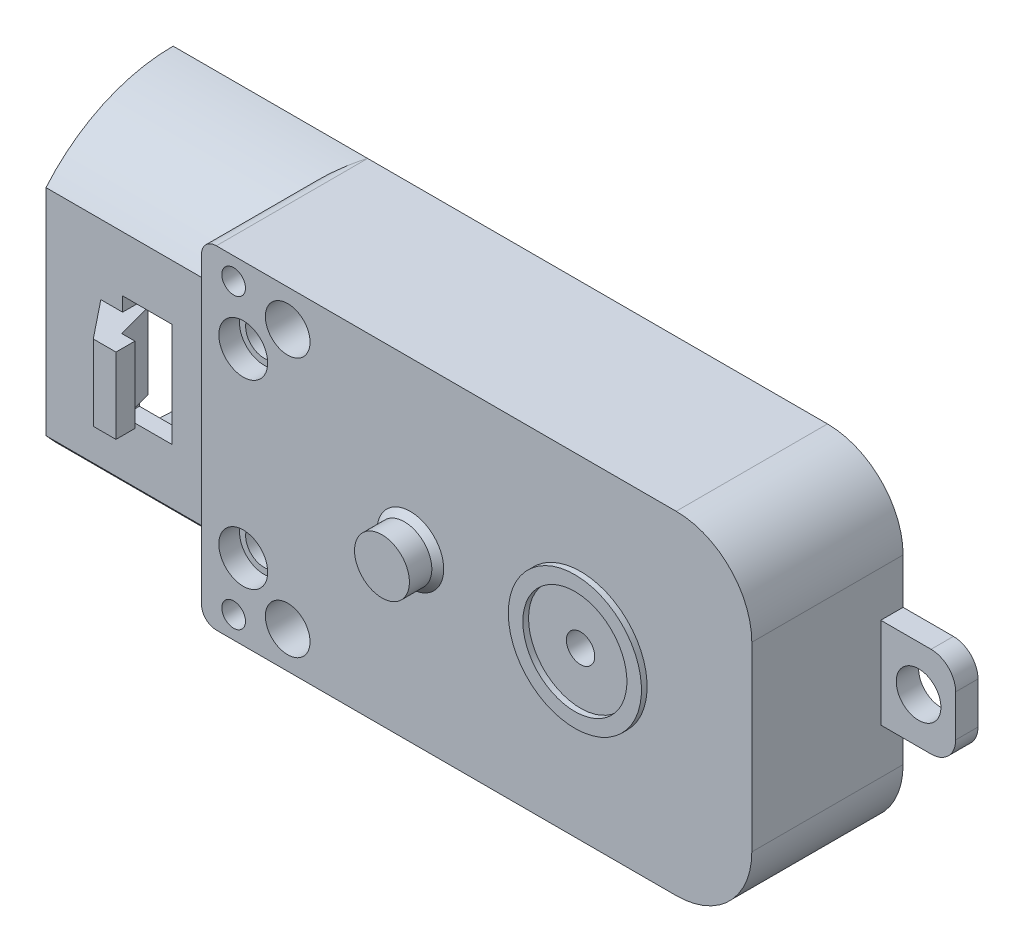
SolidWorks part; units mm, degrees
ref_plane "Front" through (0, 0, 0) normal (0, 0, 1) x (1, 0, 0)
ref_plane "Top" through (0, 0, 0) normal (0, 1, 0) x (1, 0, 0)
ref_plane "Right" through (0, 0, 0) normal (1, 0, 0) x (0, 0, -1)
sketch "Sketch1" plane through (0, 0, 0) normal (0, 0, 1) x (1, 0, 0)
  line L0 (11.5, 0) -> (-49.9329, 0) construction
  line L1 (11.5, 11.176) -> (-37.522, 11.176)
  line L2 (11.5, 11.176) -> (11.5, -11.176)
  line L3 (11.5, -11.176) -> (-37.522, -11.176)
  line L4 (-37.522, 11.176) -> (-37.522, -11.176)
  dimension "D1" = 49.022
  dimension "D2" = 22.352
  dimension "D3" = 11.5
extrude "Extrude1" add sketch "Sketch1" along normal blind 10.16
sketch "Sketch2" plane through (0, 0, 10.16) normal (0, 0, 1) x (1, 0, 0)
  line L0 (11.5, -11.176) -> (11.5, 11.176) construction
  line L4 (11.5, 11.176) -> (-37.522, 11.176) construction
  circle A0 centre (0, 0) radius 0.9525
  circle A1 centre (-22.6503, 6.0833) radius 1.2319
  circle A2 centre (-23.295, 9.691) radius 0.795
  circle A3 centre (-19.6658, 8.7122) radius 1.5
  dimension "D1" = 2.4638
  dimension "D2" = 1.59
  dimension "D3" = 1.485
  dimension "D4" = 5.0927
  dimension "D5" = 2.4638
  dimension "D6" = 3
  dimension "D7" = 31.1658
  dimension "D9" = 34.795
  dimension "D10" = 1.905
  dimension "D8" = 34.1503
extrude "Cut-Extrude1" cut sketch "Sketch2" against normal through all
ref_plane "Plane1" through (0, 0, 0) normal (0, 1, 0) x (-1, 0, 0)
mirror "Mirror1" about plane through (0, 0, 0) normal (0, 1, 0) of "Cut-Extrude1"
fillet "Fillet1" radius 5.08 2 edges at (11.5, -11.176, 5.08) (11.5, 11.176, 5.08)
sketch "Sketch3" plane through (0, 0, 10.16) normal (0, 0, 1) x (1, 0, 0)
  circle A0 centre (0, 0) radius 4.4704
  circle A1 centre (0, 0) radius 3.4925
  dimension "D1" = 6.985
  dimension "D2" = 8.9408
extrude "Extrude2" add sketch "Sketch3" along normal blind 0.381
sketch "Sketch4" plane through (-37.522, 0, 0) normal (-1, 0, 0) x (0, 0, 1)
  line L0 (10.16, 11.176) -> (0, 11.176) construction
  line L4 (10.16, 11.176) -> (10.16, -11.176) construction
  line L5 (8.5344, 7.2157) -> (8.5344, 0)
  arc A0 (8.5344, 7.2157) -> (0, 11.176) centre (0, 0) ccw
  dimension "D1" = 1.6256
extrude "Cut-Extrude-Thin1" cut sketch "Sketch4" against normal blind 12.065 thin
mirror "Mirror5" about plane through (0, 0, 0) normal (0, 1, 0) of "Cut-Extrude-Thin1"
fillet "Fillet2" radius 1 2 edges at (-25.457, 11.176, 5.08) (-25.457, -11.176, 5.08)
sketch "Sketch6" plane through (0, 0, 10.16) normal (0, 0, 1) x (1, 0, 0)
  circle A0 centre (-22.6503, 6.0833) radius 1.6404
  circle A1 centre (-22.6503, 6.0833) radius 1.2319 construction
extrude "Cut-Extrude5" cut sketch "Sketch6" against normal blind 1.39
mirror "Mirror6" about plane through (0, 0, 0) normal (0, 1, 0) of "Cut-Extrude5"
sketch "Sketch8" plane through (0, 0, 8.5344) normal (0, 0, 1) x (1, 0, 0)
  line L0 (-37.522, -7.2157) -> (-37.522, 7.2157) construction
  line L1 (-29.0765, 3.4925) -> (-32.3785, 3.4925)
  line L2 (-29.0765, 3.4925) -> (-29.0765, -3.4925)
  line L3 (-29.0765, -3.4925) -> (-32.3785, -3.4925)
  line L4 (-32.3785, 3.4925) -> (-32.3785, -3.4925)
  line L5 (-37.522, -11.176) -> (-24.457, -11.176) construction
  dimension "D1" = 6.985
  dimension "D2" = 3.302
  dimension "D3" = 5.1435
  dimension "D4" = 7.6835
extrude "Cut-Extrude8" cut sketch "Sketch8" against normal blind 10
sketch "Sketch7" plane through (-37.522, 0, 0) normal (-1, 0, 0) x (0, 0, 1)
  line L0 (8.5344, -7.2157) -> (8.5344, 7.2157) construction
  line L1 (0, 11.176) -> (0, -11.176) construction
  line L2 (8.5344, -7.2157) -> (8.5344, 7.2157) construction
  line L3 (0, 11.176) -> (0, -11.176) construction
  line L4 (7.4044, -6.7895) -> (7.4044, 6.7895)
  line L5 (0, 10.046) -> (0, -10.046)
  arc A0 (0, -11.176) -> (8.5344, -7.2157) centre (0, 0) ccw construction
  arc A1 (8.5344, 7.2157) -> (0, 11.176) centre (0, 0) ccw construction
  arc A2 (0, -11.176) -> (8.5344, -7.2157) centre (0, 0) ccw construction
  arc A3 (8.5344, 7.2157) -> (0, 11.176) centre (0, 0) ccw construction
  arc A4 (7.4044, 6.7895) -> (0, 10.046) centre (0, 0) ccw
  arc A5 (0, -10.046) -> (7.4044, -6.7895) centre (0, 0) ccw
  dimension "D1" = 1.13
extrude "Cut-Extrude7" cut sketch "Sketch7" against normal blind 12
ref_plane "Plane2" through (0, 2.54, 0) normal (0, -1, 0) x (1, 0, 0)
sketch "Sketch9" plane through (0, 2.54, 0) normal (0, -1, 0) x (1, 0, 0)
  line L0 (-33.839, 8.5344) -> (-31.807, 11.0744)
  line L1 (-31.807, 11.0744) -> (-30.283, 11.0744)
  line L2 (-30.283, 11.0744) -> (-30.283, 9.8044)
  line L3 (-30.283, 9.8044) -> (-31.172, 9.8044)
  line L4 (-31.172, 9.8044) -> (-31.807, 7.4044)
  line L5 (-31.807, 7.4044) -> (-32.3785, 7.4044)
  line L6 (-25.457, 8.5344) -> (-37.522, 8.5344) construction
  line L8 (-32.3785, 7.4044) -> (-32.3785, 8.5344)
  line L9 (-32.3785, 8.5344) -> (-33.839, 8.5344)
  line L10 (-37.522, 8.5344) -> (-37.522, 0) construction
  dimension "D1" = 2.54
  dimension "D2" = 3.683
  dimension "D3" = 5.715
  dimension "D4" = 1.27
  dimension "D5" = 7.239
  dimension "D6" = 0.889
  dimension "D7" = 5.715
extrude "Extrude3" add sketch "Sketch9" along normal blind 5.08
sketch "Sketch10" plane through (0, 0, 0) normal (0, 0, -1) x (-1, 0, 0)
  line L0 (5.2027, 0) -> (-5.2027, 0) construction
  line L1 (0, 0) -> (-14.537, 0) construction
  line L2 (-11.5, -6.096) -> (-11.5, 6.096) construction
  line L3 (-11.5, 3.048) -> (-14.8782, 3.048)
  line L4 (-11.5, 3.048) -> (-11.5, -3.048)
  line L5 (-11.5, -3.048) -> (-14.8782, -3.048)
  line L6 (-16.5292, 1.397) -> (-16.5292, -1.397)
  circle A0 centre (-14.04, 0) radius 1.5
  arc A1 (-14.8782, -3.048) -> (-16.5292, -1.397) centre (-14.8782, -1.397) cw
  arc A2 (-14.8782, 3.048) -> (-16.5292, 1.397) centre (-14.8782, 1.397) ccw
  dimension "D1" = 3
  dimension "D2" = 3.048
  dimension "D3" = 6.096
  dimension "D5" = 1.651
  dimension "D4" = 5.0292
  dimension "D6" = 2.54
extrude "Extrude4" add sketch "Sketch10" against normal blind 1.5
sketch "Sketch12" plane through (0, 0, 10.16) normal (0, 0, 1) x (1, 0, 0)
  line L0 (5.2027, 0) -> (-5.2027, 0) construction
  circle A0 centre (-11.43, 0) radius 1.8415
  dimension "D2" = 3.683
  dimension "D1" = 11.43
extrude "Extrude6" add sketch "Sketch12" along normal blind 1.905
chamfer "Chamfer1" distance 0.4 angle 45 1 edges at (-13.2715, 0, 10.16)
